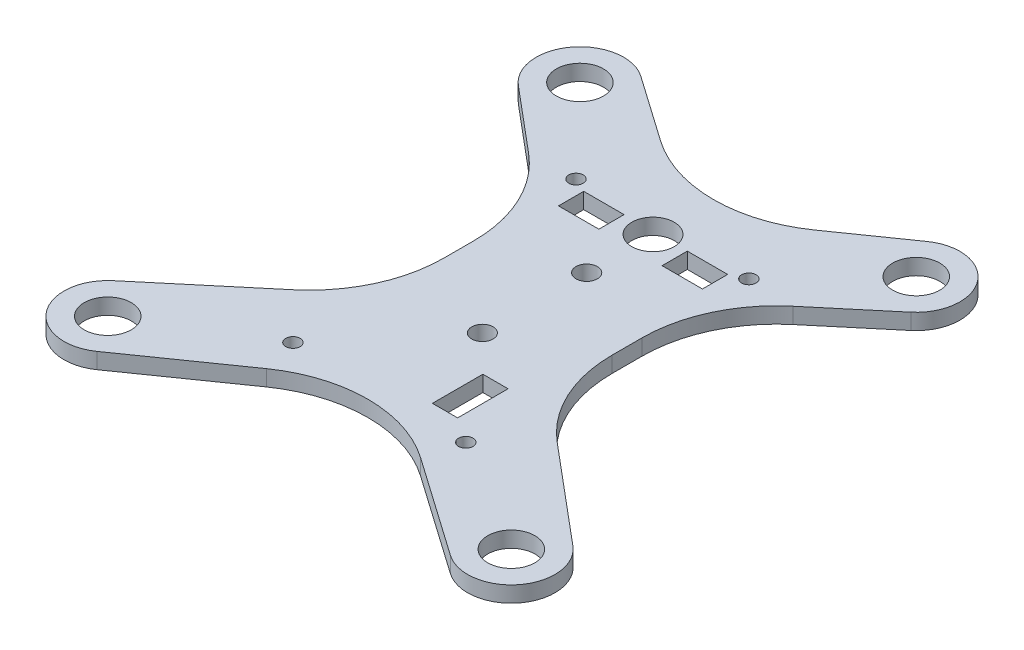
SolidWorks part; units mm, degrees
ref_plane "Front Plane" through (0, 0, 0) normal (0, 0, 1) x (1, 0, 0)
ref_plane "Top Plane" through (0, 0, 0) normal (0, 1, 0) x (1, 0, 0)
ref_plane "Right Plane" through (0, 0, 0) normal (1, 0, 0) x (0, 0, -1)
sketch "Sketch1" plane through (0, 0, 0) normal (0, 1, 0) x (1, 0, 0)
  line L0 (0, 80.7788) -> (0, -72.1346) construction
  line L1 (-105.8173, 0) -> (107.6058, 0) construction
  line L2 (12.5, 16.0261) -> (12.5, -7.0306)
  line L3 (12.5, -7.0306) -> (34.1781, -25.2207)
  line L4 (12.5, 16.0261) -> (29.1781, 30.0207)
  line L5 (21.2718, 40.3245) -> (0, 25.4298)
  line L6 (26.2718, -35.5245) -> (0, -17.1288)
  line L7 (-26.2718, -35.5245) -> (0, -17.1288)
  line L8 (-21.2718, 40.3245) -> (0, 25.4298)
  line L9 (-12.5, 16.0261) -> (-29.1781, 30.0207)
  line L10 (-12.5, -7.0306) -> (-34.1781, -25.2207)
  line L11 (-12.5, 16.0261) -> (-12.5, -7.0306)
  circle A0 centre (0, -4.5) radius 1.5793
  arc A1 (29.1781, 30.0207) -> (21.2718, 40.3245) centre (25, 35) ccw
  circle A2 centre (0, 11) radius 1.5875
  arc A3 (26.2718, -35.5245) -> (34.1781, -25.2207) centre (30, -30.2) ccw
  arc A4 (-26.2718, -35.5245) -> (-34.1781, -25.2207) centre (-30, -30.2) cw
  arc A5 (-29.1781, 30.0207) -> (-21.2718, 40.3245) centre (-25, 35) cw
  point P8 (25, 35)
  point P12 (30, -30.2)
  point P40 (-25, 35)
  point P41 (-30, -30.2)
  dimension "D2" = 3.175
  dimension "D5" = 30
  dimension "D6" = 30.2
  dimension "D7" = 35
  dimension "D8" = 13
  dimension "D10" = 55
  dimension "D3" = 11
  dimension "D11" = 55
  dimension "D1" = 15.5
  dimension "D4" = 25
  dimension "D9" = 25
  dimension "D12" = 5
  dimension "D13" = 5
extrude "Boss-Extrude1" add sketch "Sketch1" against normal blind 2.3622
hole_wizard "Ø7.0 (7) Diameter Hole1" positions "Sketch5" profile "Sketch4" hole size "Ø7.0" standard "ANSI Metric"
sketch "Sketch5" plane through (0, 0, 0) normal (0, 1, 0) x (1, 0, 0)
  point P0 (-25, 35)
  point P3 (25, 35)
  point P6 (30, -30.2)
  point P9 (-30, -30.2)
sketch "Sketch4" plane through (-25, 0, -35) normal (1, 0, 0) x (0, 0, 1)
  line L0 (0, 0) -> (0, 2.3622)
  line L1 (0, 2.3622) -> (3.5, 2.3622)
  line L2 (3.5, 2.3622) -> (3.5, 0)
  line L5 (3.5, 0) -> (0, 0)
  line L11 (0, -6.35) -> (0, 107.95) construction
  dimension "Thru Hole Dia." = 7
  dimension "Thru Hole Depth" = 2.3622
fillet "Fillet1" radius 20 6 edges at (-12.5, -1.1811, 7.0306) (-12.5, -1.1811, -16.0261) (0, -1.1811, -25.4298) (12.5, -1.1811, -16.0261) (12.5, -1.1811, 7.0306) (0, -1.1811, 17.1288)
sketch "Sketch7" plane through (0, 0, 0) normal (0, 1, 0) x (1, 0, 0)
  line L1 (-10.7, 21.2631) -> (-4.7, 21.2631)
  line L2 (-10.7, 21.2631) -> (-10.7, 17.5131)
  line L3 (-10.7, 17.5131) -> (-4.7, 17.5131)
  line L4 (-4.7, 21.2631) -> (-4.7, 17.5131)
  line L5 (4.7, 21.2631) -> (10.7, 21.2631)
  line L6 (4.7, 21.2631) -> (4.7, 17.5131)
  line L7 (4.7, 17.5131) -> (10.7, 17.5131)
  line L8 (10.7, 21.2631) -> (10.7, 17.5131)
  line L9 (5.35, -9.7826) -> (9.1, -9.7826)
  line L10 (5.35, -9.7826) -> (5.35, -17.2826)
  line L11 (5.35, -17.2826) -> (9.1, -17.2826)
  line L12 (9.1, -9.7826) -> (9.1, -17.2826)
  circle A0 centre (0, 20.8631) radius 3.15
  circle A3 centre (0, 20.8631) radius 3.15 construction
  circle A4 centre (-12.85, 22.2631) radius 1.075
  circle A5 centre (12.85, 22.2631) radius 1.075
  circle A6 centre (12.85, -19.8169) radius 1.075
  circle A7 centre (-12.85, -19.8169) radius 1.075
  circle A10 centre (-12.85, 22.2631) radius 1.075 construction
extrude "Cut-Extrude1" cut sketch "Sketch7" against normal through all contours L4 L1 L2 L3 | A0 | L8 L5 L6 L7 | A5 | A4 | A7 | A6 | L12 L9 L10 L11
